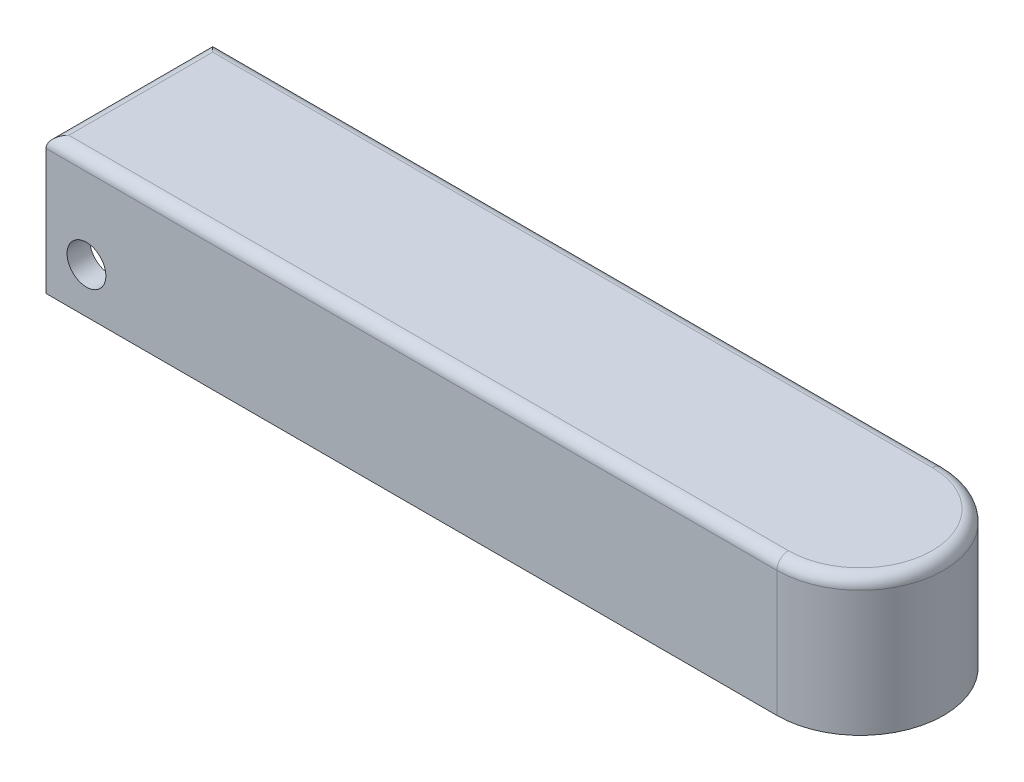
SolidWorks part; units mm, degrees
ref_plane "Front Plane" through (0, 0, 0) normal (0, 0, 1) x (1, 0, 0)
ref_plane "Top Plane" through (0, 0, 0) normal (0, 1, 0) x (1, 0, 0)
ref_plane "Right Plane" through (0, 0, 0) normal (1, 0, 0) x (0, 0, -1)
sketch "Sketch1"
  dimension "D1" = 92.71
  dimension "D2" = 406.4
extrude "Extrude1" add sketch "Sketch1" along normal blind 76.2
sketch "Sketch2"
  dimension "D1" = 12.7
extrude "Extrude2" cut sketch "Sketch2" against normal blind 38.1
sketch "Sketch3"
extrude "Extrude3" cut sketch "Sketch3" against normal blind 25.4
sketch "Sketch4"
extrude "Extrude4" cut sketch "Sketch4" against normal through all
fillet "Fillet1" radius 6.35 4 edges at (203.2, 76.2, -92.71) (452.755, 76.2, -46.355) (0, 76.2, -46.355) (203.2, 76.2, 0)
